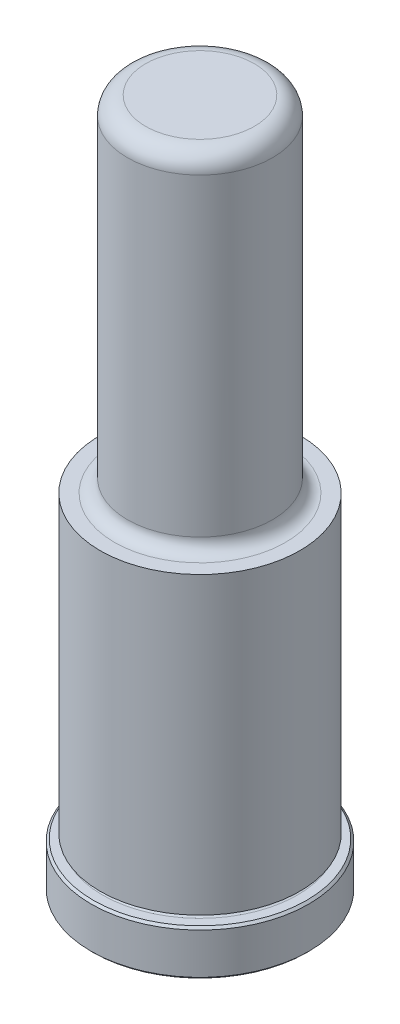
SolidWorks part; units mm, degrees
ref_plane "Front Plane" through (0, 0, 0) normal (0, 0, 1) x (1, 0, 0)
ref_plane "Top Plane" through (0, 0, 0) normal (0, 1, 0) x (1, 0, 0)
ref_plane "Right Plane" through (0, 0, 0) normal (1, 0, 0) x (0, 0, -1)
sketch "Sketch1" plane through (0, 0, 0) normal (1, 0, 0) x (0, 0, -1)
  line L0 (0, 0) -> (19.05, 0)
  line L1 (19.05, 0) -> (19.05, 7.9248)
  line L2 (19.05, 7.9248) -> (17.0688, 7.9248)
  line L3 (16.6878, 2.6782) -> (16.6878, 5.9795) construction
  line L4 (17.0688, 8.6868) -> (17.4752, 8.6868)
  line L5 (17.4752, 8.6868) -> (17.4752, 60.325)
  line L6 (17.4752, 60.325) -> (14.9733, 60.325)
  line L7 (12.6873, 62.611) -> (12.6873, 120.65)
  line L9 (12.6873, 120.65) -> (0, 120.65)
  line L10 (0, 120.65) -> (0, 0)
  line L11 (0, 0) -> (0, -7.2694) construction
  arc A0 (17.0688, 8.6868) -> (17.0688, 7.9248) centre (17.0688, 8.3058) ccw
  arc A1 (14.9733, 60.325) -> (12.6873, 62.611) centre (14.9733, 62.611) cw
  point P2 (12.6873, 120.65)
  point P14 (12.6873, 120.3145)
  point P19 (12.6873, 60.325)
  dimension "D14" = 0.762
  dimension "D8" = 2.286
  dimension "T" = 7.9248
  dimension "D2" = 0.762
  dimension "M" = 38.1
  dimension "B" = 34.9504
  dimension "L" = 120.65
  dimension "D7" = 0.7874
  dimension "A" = 60.325
  dimension "D" = 25.3746
  dimension "D15" = 60.325
revolve "Revolve1" add sketch "Sketch1" angle 360 about L11
chamfer "Chamfer1" distance 0.381 angle 45 2 edges at (0, 0, 19.05) (0, 7.9248, 19.05)
fillet "Fillet7" radius 3.175 1 edges at (0, 120.65, 12.6873)
